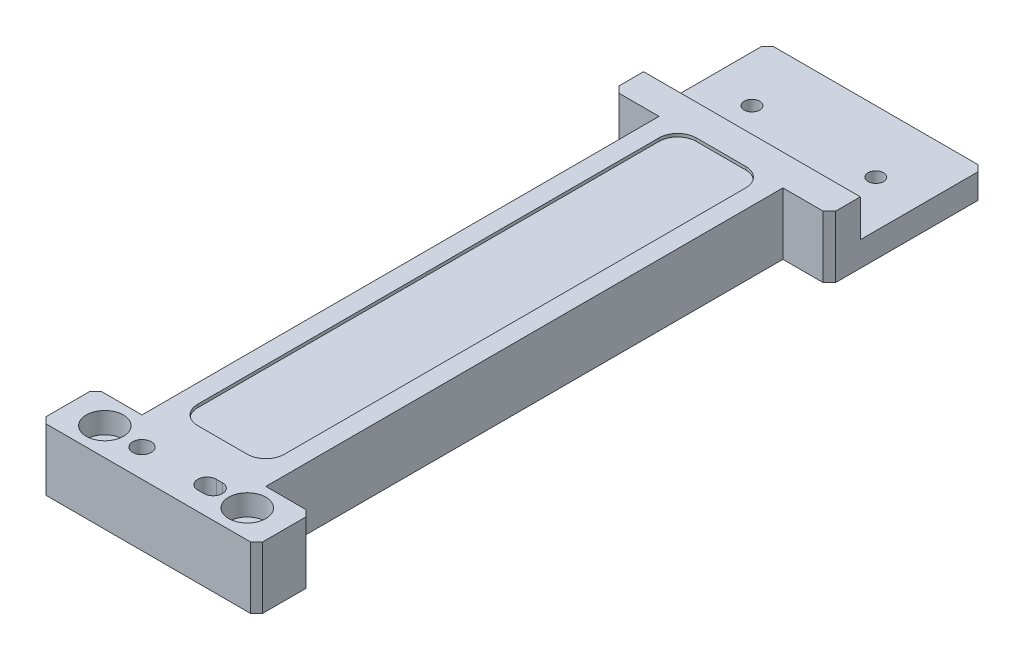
SolidWorks part; units mm, degrees
ref_plane "前视" through (0, 0, 0) normal (0, 0, 1) x (1, 0, 0)
ref_plane "上视" through (0, 0, 0) normal (0, 1, 0) x (1, 0, 0)
ref_plane "右视" through (0, 0, 0) normal (1, 0, 0) x (0, 0, -1)
other "边界框"
ref_plane "Default Plane" through (-12.5, 0, -80.75) normal (1, 0, 0) x (0, 0, -1)
sketch "草图1" plane through (0, 0, 0) normal (0, 1, 0) x (1, 0, 0)
  line L1 (17.5, -58.75) -> (-17.5, -58.75)
  line L2 (17.5, -58.75) -> (17.5, 58.75)
  line L3 (17.5, 58.75) -> (-17.5, 58.75)
  line L4 (-17.5, -58.75) -> (-17.5, 58.75)
  line L5 (17.5, -58.75) -> (-17.5, 58.75) construction
  line L6 (17.5, 58.75) -> (-17.5, -58.75) construction
  point P0 (0, 0)
  dimension "D1" = 35
  dimension "D2" = 117.5
extrude "凸台-拉伸1" add sketch "草图1" along normal blind 10
sketch "草图6" plane through (0, 10, 0) normal (0, 1, 0) x (1, 0, 0)
  line L0 (17.5, -58.75) -> (17.5, 58.75) construction
  line L1 (17.5, 38.75) -> (-17.5, 38.75)
  line L2 (17.5, 38.75) -> (17.5, 58.75)
  line L3 (17.5, 58.75) -> (-17.5, 58.75)
  line L4 (-17.5, 38.75) -> (-17.5, 58.75)
  line L5 (17.5, 58.75) -> (-17.5, 58.75) construction
  line L6 (-17.5, 58.75) -> (-17.5, -58.75) construction
  dimension "D1" = 20
extrude "切除-拉伸4" cut sketch "草图6" against normal blind 6
sketch "草图16" plane through (0, 0, 0) normal (0, -1, 0) x (1, 0, 0)
  line L0 (0, 0) -> (0, 50000) construction
  line L1 (-17.5, -33.75) -> (-10, -33.75)
  line L2 (-17.5, -33.75) -> (-17.5, 49.75)
  line L3 (-17.5, 49.75) -> (-10, 49.75)
  line L4 (-10, -33.75) -> (-10, 49.75)
  line L5 (10, -33.75) -> (10, 49.75)
  line L6 (17.5, 49.75) -> (10, 49.75)
  line L7 (17.5, -33.75) -> (17.5, 49.75)
  line L8 (17.5, -33.75) -> (10, -33.75)
  line L9 (-17.5, 58.75) -> (17.5, 58.75) construction
  line L11 (-17.5, -58.75) -> (-17.5, 58.75) construction
  dimension "D1" = 20
  dimension "D2" = 9
  dimension "D3" = 83.5
extrude "切除-拉伸6" cut sketch "草图16" against normal through all
chamfer "倒角2" distance 1 angle 45 8 edges at (-17.5, 2, -58.75) (17.5, 2, -58.75) (17.5, 5, 58.75) (17.5, 5, 49.75) (-17.5, 5, 49.75) (-17.5, 5, 58.75) (17.5, 5, -33.75) (-17.5, 5, -33.75)
hole_wizard "M3 六角圆柱头螺钉的柱形沉头孔1" positions "草图10" profile "草图11" counterbore size "M3" standard "GB"
sketch "草图10" plane through (0, 10, 0) normal (0, 1, 0) x (1, 0, 0)
  line L0 (-16.5, -58.75) -> (16.5, -58.75) construction
  line L1 (0, 0) -> (0, 50000) construction
  point P0 (-11.5, -54.25)
  point P2 (11.5, -54.25)
  dimension "D1" = 4.5
  dimension "D2" = 23
sketch "草图11" plane through (-11.5, 10, 54.25) normal (1, 0, 0) x (0, 0, 1)
  line L0 (0, 0) -> (0, 10)
  line L1 (0, 10) -> (1.7, 10)
  line L3 (1.7, 10) -> (1.7, 3.4)
  line L4 (1.7, 3.4) -> (3, 3.4)
  line L5 (3, 3.4) -> (3, 0)
  line L7 (3, 0) -> (0, 0)
  line L11 (0, -6.35) -> (0, 107.95) construction
  dimension "通孔孔直径" = 3.4
  dimension "通孔孔深度" = 10
  dimension "柱形沉头孔直径" = 6
  dimension "柱形沉头孔深度" = 3.4
hole_wizard "Ø3.0mm 暗销孔1" positions "草图12" profile "草图13" hole size "Ø3.0" standard "GB"
sketch "草图12" plane through (0, 10, 0) normal (0, 1, 0) x (1, 0, 0)
  line L0 (-11.5, -54.25) -> (11.5, -54.25) construction
  point P0 (-5.5, -54.25)
  dimension "D1" = 6
sketch "草图13" plane through (-5.5, 10, 54.25) normal (1, 0, 0) x (0, 0, 1)
  line L0 (0, 0) -> (0, 10)
  line L1 (0, 10) -> (1.5, 10)
  line L2 (1.5, 10) -> (1.5, 0)
  line L5 (1.5, 0) -> (0, 0)
  line L11 (0, -6.35) -> (0, 107.95) construction
  dimension "通孔孔直径" = 3
  dimension "通孔孔深度" = 10
hole_wizard "Ø3.0mm 暗销槽口1" positions "草图14" profile "草图15" size "Ø3.0" standard "GB"
sketch "草图14" plane through (0, 10, 0) normal (0, 1, 0) x (1, 0, 0)
  line L0 (3.5, -54.25) -> (7.5, -54.25) construction
  line L1 (-11.5, -54.25) -> (11.5, -54.25) construction
  point P0 (5.5, -54.25)
  dimension "D1" = 4
  dimension "D2" = 6
sketch "草图15" plane through (5.5, 10, 54.25) normal (1, 0, 0) x (0, 0, 1)
  line L0 (0, 0) -> (0, 10)
  line L1 (0, 10) -> (1.5, 10)
  line L2 (1.5, 10) -> (1.5, 0)
  line L5 (1.5, 0) -> (0, 0)
  line L11 (0, -6.35) -> (0, 107.95) construction
  dimension "通孔孔直径" = 3
  dimension "通孔孔深度" = 10
hole_wizard "M3 螺纹孔2" positions "草图20" profile "草图21" tap size "M3" standard "ISO"
sketch "草图20" plane through (0, 4, 0) normal (0, 1, 0) x (1, 0, 0)
  line L0 (16.5, 58.75) -> (-16.5, 58.75) construction
  line L1 (0, 58.75) -> (0, 38.75) construction
  line L2 (-17.5, 38.75) -> (17.5, 38.75) construction
  point P0 (-10, 48.75)
  point P2 (10, 48.75)
  dimension "D1" = 20
  dimension "D2" = 10
sketch "草图21" plane through (-10, 4, -48.75) normal (1, 0, 0) x (0, 0, 1)
  line L0 (0, 0) -> (0, 4)
  line L1 (0, 4) -> (1.25, 4)
  line L2 (1.25, 4) -> (1.25, 0)
  line L5 (1.25, 0) -> (0, 0)
  line L11 (0, -6.35) -> (0, 107.95) construction
  dimension "通孔螺纹孔钻头直径" = 2.5
  dimension "通孔螺纹孔钻头深度" = 4
sketch "草图22" plane through (0, 0, 0) normal (0, -1, 0) x (1, 0, 0)
  line L0 (0, 6.5) -> (0, 0) construction
  line L1 (-7, 46.75) -> (7, 46.75)
  line L2 (-7, 46.75) -> (-7, -33.75)
  line L3 (-7, -33.75) -> (7, -33.75)
  line L4 (7, 46.75) -> (7, -33.75)
  line L5 (-7, 46.75) -> (7, -33.75) construction
  line L6 (-7, -33.75) -> (7, 46.75) construction
  line L7 (-10, -33.75) -> (-10, 49.75) construction
  line L8 (-16.5, -33.75) -> (-10, -33.75) construction
  line L9 (-16.5, 58.75) -> (16.5, 58.75) construction
  point P0 (0, 6.5)
  dimension "D1" = 3
  dimension "D3" = 12
extrude "切除-拉伸7" cut sketch "草图22" against normal blind 0.5
fillet "圆角1" radius 3 4 edges at (-7, 0.25, 46.75) (7, 0.25, 46.75) (-7, 0.25, -33.75) (7, 0.25, -33.75)
ref_plane "基准面1" through (0, 5, 0) normal (0, 1, 0) x (1, 0, 0)
mirror "镜向1" about plane through (0, 5, 0) normal (0, 1, 0) of "圆角1", "切除-拉伸7"
sketch "草图24" plane through (0, 0, 0) normal (0, -1, 0) x (1, 0, 0)
  circle A0 centre (-11.5, 54.25) radius 3
  circle A1 centre (11.5, 54.25) radius 3
  dimension "D1" = 6
extrude "切除-拉伸9" cut sketch "草图24" against normal blind 3.4
